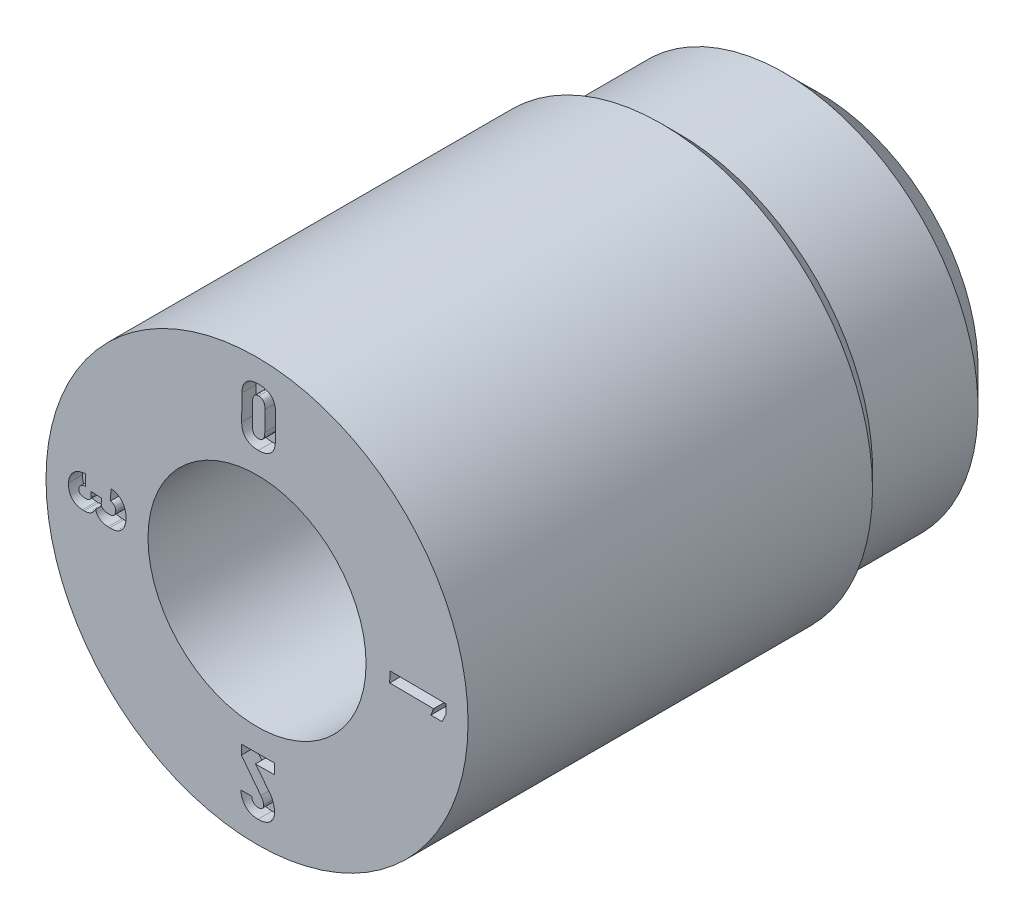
SolidWorks part; units mm, degrees
ref_plane "Front Plane" through (0, 0, 0) normal (0, 0, 1) x (1, 0, 0)
ref_plane "Top Plane" through (0, 0, 0) normal (0, 1, 0) x (1, 0, 0)
ref_plane "Right Plane" through (0, 0, 0) normal (1, 0, 0) x (0, 0, -1)
sketch "Sketch2" plane through (0, 0, 0) normal (0, 1, 0) x (1, 0, 0)
  line L0 (0, 4.8491) -> (0, -49995.1509) construction
  line L10 (2.2496, 8) -> (0.8, 8)
  line L11 (2.75, 7.4996) -> (2.2496, 8)
  line L12 (2.75, 6) -> (2.75, 7.4996)
  line L13 (3, 5.75) -> (2.75, 6)
  line L14 (3, 0) -> (3, 5.75)
  line L15 (1.55, 0) -> (3, 0)
  line L16 (1.55, 0) -> (1.55, 5.5)
  line L17 (0.8, 5.5) -> (1.55, 5.5)
  line L18 (0.8, 5.5) -> (0.8, 8)
  dimension "D1" = 6
  dimension "D2" = 3.1
  dimension "D3" = 2.5
  dimension "D4" = 1.6
  dimension "D5" = 5.5
  dimension "D6" = 8
  dimension "D7" = 45
  dimension "D8" = 45
  dimension "D9" = 2
  dimension "D10" = 0.5004
revolve "Revolve1" add sketch "Sketch2" angle 360 about L0
sketch "Sketch7" plane through (0, 0, 0) normal (0, 0, 1) x (1, 0, 0)
  arc A0 (-0.2926, 1.8735) -> (-0.5792, 1.8055) centre (0, 0) cw construction
  circle A54 centre (0, 0) radius 3 construction
  text T0 "3       2       1       0" font "Bahnschrift" height 0.8
extrude "Cut-Extrude1" cut sketch "Sketch7" against normal blind 0.2
